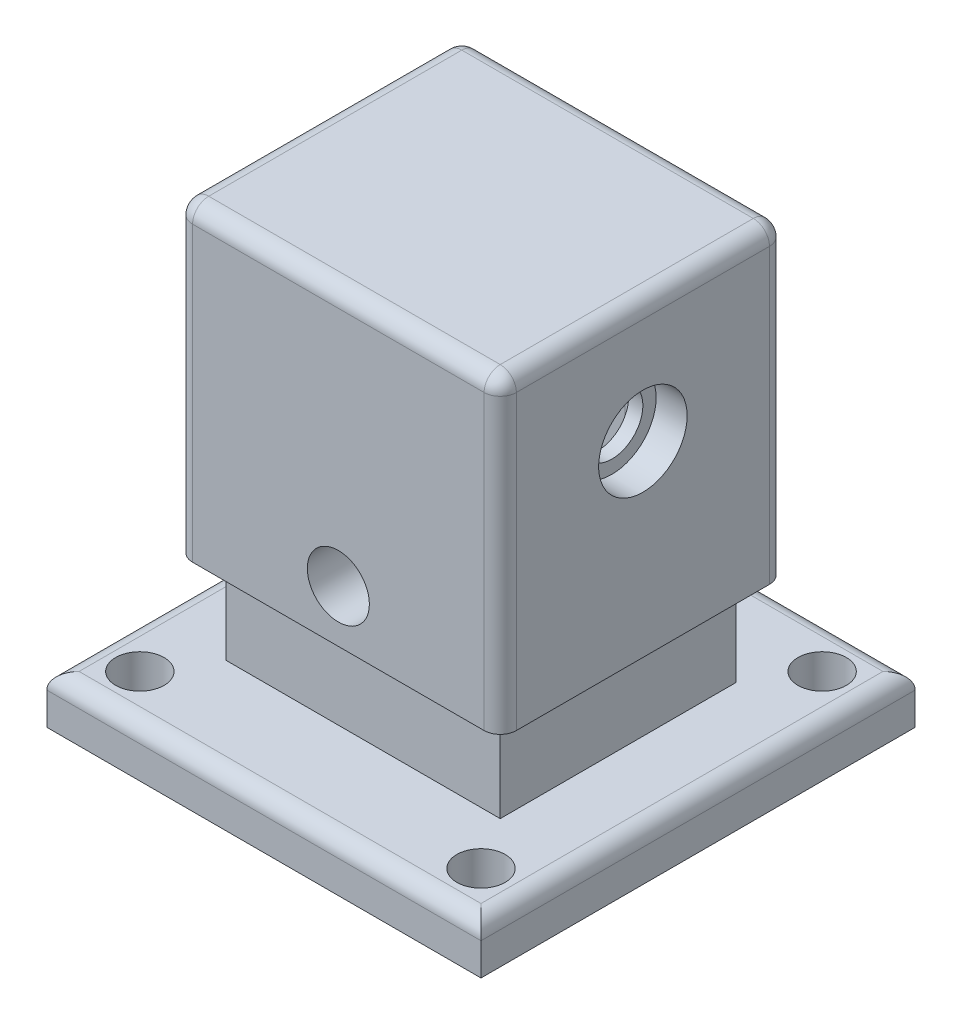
SolidWorks part; units mm, degrees
ref_plane "Front Plane" through (0, 0, 0) normal (0, 0, 1) x (1, 0, 0)
ref_plane "Top Plane" through (0, 0, 0) normal (0, 1, 0) x (1, 0, 0)
ref_plane "Right Plane" through (0, 0, 0) normal (1, 0, 0) x (0, 0, -1)
sketch "Sketch1" plane through (0, 0, 0) normal (0, 1, 0) x (1, 0, 0)
  line L0 (0, 0) -> (0, 44.45) construction
  line L5 (-44.45, 44.45) -> (44.45, 44.45)
  line L6 (-44.45, 44.45) -> (-44.45, -44.45)
  line L7 (-44.45, -44.45) -> (44.45, -44.45)
  line L8 (44.45, 44.45) -> (44.45, -44.45)
  line L9 (-44.45, 44.45) -> (44.45, -44.45) construction
  line L10 (-44.45, -44.45) -> (44.45, 44.45) construction
  circle A4 centre (-34.925, 34.925) radius 4.953
  circle A5 centre (34.925, 34.925) radius 4.953
  circle A6 centre (34.925, -34.925) radius 4.953
  circle A7 centre (-34.925, -34.925) radius 4.953
  point P0 (0, 0)
  dimension "D3" = 9.906
  dimension "D4" = 69.85
  dimension "D5" = 69.85
  dimension "D1" = 88.9
  dimension "D2" = 88.9
extrude "Boss-Extrude2" add sketch "Sketch1" along normal blind 9.906
sketch "Sketch2" plane through (0, 9.906, 0) normal (0, 1, 0) x (1, 0, 0)
  line L1 (-28.067, 24.13) -> (28.067, 24.13)
  line L2 (-28.067, 24.13) -> (-28.067, -24.13)
  line L3 (-28.067, -24.13) -> (28.067, -24.13)
  line L4 (28.067, 24.13) -> (28.067, -24.13)
  line L5 (-28.067, 24.13) -> (28.067, -24.13) construction
  line L6 (-28.067, -24.13) -> (28.067, 24.13) construction
  point P0 (0, 0)
  dimension "D1" = 56.134
  dimension "D2" = 48.26
extrude "Boss-Extrude3" add sketch "Sketch2" along normal blind 19.05
sketch "Sketch3" plane through (0, 28.956, 0) normal (0, 1, 0) x (1, 0, 0)
  line L1 (-33.147, 29.21) -> (33.147, 29.21)
  line L2 (-33.147, 29.21) -> (-33.147, -29.21)
  line L3 (-33.147, -29.21) -> (33.147, -29.21)
  line L4 (33.147, 29.21) -> (33.147, -29.21)
  line L5 (-33.147, 29.21) -> (33.147, -29.21) construction
  line L6 (-33.147, -29.21) -> (33.147, 29.21) construction
  point P0 (0, 0)
  dimension "D1" = 66.294
  dimension "D2" = 58.42
extrude "Boss-Extrude4" add sketch "Sketch3" along normal blind 63.246
sketch "Sketch4" plane through (0, 0, 0) normal (0, -1, 0) x (-1, 0, 0)
  line L1 (23.876, -12.7) -> (-23.876, -12.7)
  line L2 (23.876, -12.7) -> (23.876, 12.7)
  line L3 (23.876, 12.7) -> (-23.876, 12.7)
  line L4 (-23.876, -12.7) -> (-23.876, 12.7)
  line L5 (23.876, -12.7) -> (-23.876, 12.7) construction
  line L6 (23.876, 12.7) -> (-23.876, -12.7) construction
  point P0 (0, 0)
  dimension "D1" = 47.752
  dimension "D2" = 25.4
extrude "Cut-Extrude1" cut sketch "Sketch4" against normal blind 76.2
sketch "Sketch5" plane through (0, 0, 0) normal (0, -1, 0) x (-1, 0, 0)
  line L1 (30.226, -19.05) -> (-30.226, -19.05)
  line L2 (30.226, -19.05) -> (30.226, 19.05)
  line L3 (30.226, 19.05) -> (-30.226, 19.05)
  line L4 (-30.226, -19.05) -> (-30.226, 19.05)
  line L5 (30.226, -19.05) -> (-30.226, 19.05) construction
  line L6 (30.226, 19.05) -> (-30.226, -19.05) construction
  point P0 (0, 0)
  dimension "D1" = 60.452
  dimension "D2" = 38.1
extrude "Cut-Extrude4" cut sketch "Sketch5" against normal blind 3.302
sketch "Sketch6" plane through (33.147, 0, 0) normal (1, 0, 0) x (0, 0, -1)
  line L0 (-44.45, 0) -> (44.45, 0) construction
  circle A1 centre (0, 67.31) radius 6.35
  dimension "D3" = 12.7
  dimension "D1" = 67.31
extrude "Cut-Extrude7" cut sketch "Sketch6" against normal through all
sketch "Sketch7" plane through (33.147, 0, 0) normal (1, 0, 0) x (0, 0, -1)
  line L0 (-44.45, 0) -> (44.45, 0) construction
  circle A0 centre (0, 67.31) radius 9.0577
  dimension "D1" = 67.31
extrude "Cut-Extrude8" cut sketch "Sketch7" against normal blind 6.35
mirror "Mirror1" about plane through (0, 0, 0) normal (1, 0, 0) of "Cut-Extrude8"
sketch "Sketch8" plane through (0, 0, 29.21) normal (0, 0, 1) x (1, 0, 0)
  line L0 (-44.45, 0) -> (44.45, 0) construction
  circle A0 centre (0, 39.624) radius 6.35
  dimension "D1" = 12.7
  dimension "D2" = 39.624
extrude "Cut-Extrude9" cut sketch "Sketch8" against normal through all
fillet "Fillet1" radius 3.302 12 edges at (0, 9.906, 44.45) (-44.45, 9.906, 0) (44.45, 9.906, 0) (0, 9.906, -44.45) (0, 92.202, -29.21) (33.147, 92.202, 0) (-33.147, 92.202, 0) (0, 92.202, 29.21) (33.147, 60.579, -29.21) (-33.147, 60.579, -29.21) (-33.147, 60.579, 29.21) (33.147, 60.579, 29.21)
fillet "Fillet2" radius 7.112 4 edges at (-23.876, 39.751, 12.7) (23.876, 39.751, 12.7) (23.876, 39.751, -12.7) (-23.876, 39.751, -12.7)
fillet "Fillet3" radius 3.302 4 edges at (30.226, 1.651, -19.05) (30.226, 1.651, 19.05) (-30.226, 1.651, -19.05) (-30.226, 1.651, 19.05)
hole_wizard "#4-40 Tapped Hole3" positions "Sketch21" profile "Sketch22" tap size "#4-40" standard "ANSI Inch"
sketch "Sketch21" plane through (0, 3.302, 0) normal (0, -1, 0) x (-1, 0, 0)
  line L0 (0, 0) -> (0, -26.8775) construction
  line L2 (0, 0) -> (-63.4666, 0) construction
  line L4 (0, 0) -> (41.772, 0) construction
  line L6 (0, 0) -> (0, 33.9148) construction
  point P0 (26.289, -15.113)
  point P3 (-26.289, -15.113)
  point P5 (-26.289, 15.113)
  point P7 (26.289, 15.113)
  point P30 (0, 0)
  point P31 (0, 0)
  point P32 (0, 0)
  point P33 (0, 0)
  dimension "D1" = 52.578
  dimension "D2" = 30.226
sketch "Sketch22" plane through (-26.289, 3.302, 15.113) normal (1, 0, 0) x (0, 0, -1)
  line L0 (0, 0) -> (0, 9.5692)
  line L1 (0, 9.5692) -> (1.1303, 8.89)
  line L2 (1.1303, 8.89) -> (1.1303, 0)
  line L5 (1.1303, 0) -> (0, 0)
  line L10 (0, 9.5692) -> (-1.1303, 8.89) construction
  line L11 (0, -6.35) -> (0, 107.95) construction
  dimension "Tap Drill Dia." = 2.2606
  dimension "Tap Drill Depth" = 8.89
  dimension "Drill Angle" = 118
